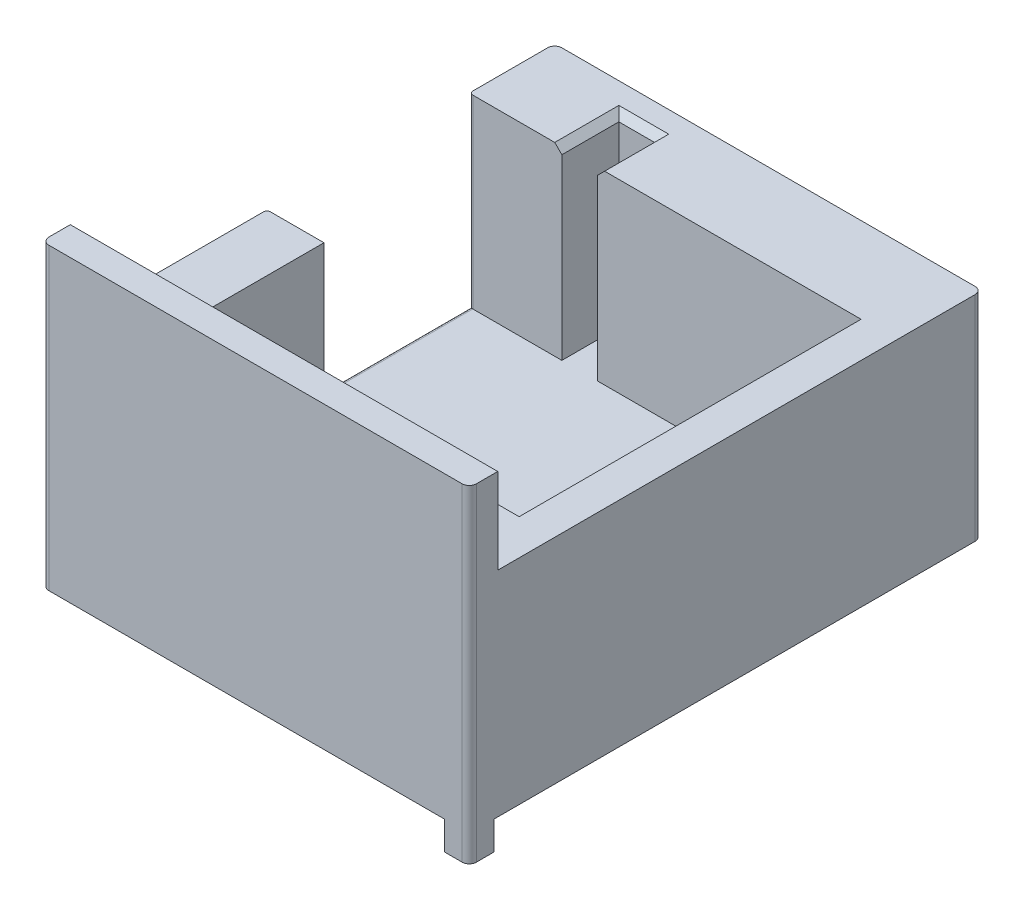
SolidWorks part; units mm, degrees
ref_plane "前视基准面" through (0, 0, 0) normal (0, 0, 1) x (1, 0, 0)
ref_plane "上视基准面" through (0, 0, 0) normal (0, 1, 0) x (1, 0, 0)
ref_plane "右视基准面" through (0, 0, 0) normal (1, 0, 0) x (0, 0, -1)
sketch "草图1" plane through (0, 0, 0) normal (0, 1, 0) x (1, 0, 0)
  line L1 (-15, -18) -> (15, -18)
  line L2 (-15, -18) -> (-15, 18)
  line L3 (-15, 18) -> (15, 18)
  line L4 (15, -18) -> (15, 18)
  line L5 (-15, -18) -> (15, 18) construction
  line L6 (-15, 18) -> (15, -18) construction
  point P0 (0, 0)
  dimension "D1" = 30
  dimension "D2" = 36
extrude "凸台-拉伸1" add sketch "草图1" along normal blind 15
sketch "草图4" plane through (0, 15, 0) normal (0, 1, 0) x (1, 0, 0)
  line L0 (-18.185, 0) -> (17.1592, 0) construction
  line L1 (12.5, 12) -> (12.5, -12)
  line L2 (12.5, -12) -> (-6, -12)
  line L3 (-6, -12) -> (-6, -16)
  line L4 (-6, -16) -> (-8.5, -16)
  line L5 (-8.5, -16) -> (-8.5, -12)
  line L6 (-8.5, -12) -> (-11, -12)
  line L7 (-15, 18) -> (-15, -18) construction
  line L8 (-11, -12) -> (-11, 12)
  line L9 (15, -18) -> (15, 18) construction
  line L10 (-8.5, 12) -> (-11, 12)
  line L11 (-8.5, 16) -> (-8.5, 12)
  line L12 (-6, 16) -> (-8.5, 16)
  line L13 (-6, 12) -> (-6, 16)
  line L14 (12.5, 12) -> (-6, 12)
  point P16 (-11, 0)
  point P21 (12.5, 0)
  dimension "D1" = 2.5
  dimension "D2" = 9
  dimension "D3" = 2.5
  dimension "D4" = 24
  dimension "D5" = 16
  dimension "D6" = 24
  dimension "D7" = 4
extrude "切除-拉伸3" cut sketch "草图4" against normal blind 13
sketch "草图6" plane through (-15, 0, 0) normal (-1, 0, 0) x (0, 0, 1)
  line L0 (0, 14.3) -> (0, 2) construction
  line L1 (-18, 0) -> (18, 0) construction
  line L2 (0, 8.15) -> (19.5542, 8.15) construction
  line L3 (12, 2) -> (12, 15) construction
  line L4 (12, 2) -> (12, 15) construction
  line L5 (12, 8.15) -> (12, 15)
  line L6 (12, 15) -> (-2.1962, 15)
  line L7 (-18, 15) -> (18, 15) construction
  line L8 (-2.1962, 15) -> (-2.1962, 8.15)
  line L9 (2.1962, 15) -> (2.1962, 8.15)
  line L10 (-12, 15) -> (2.1962, 15)
  line L11 (-12, 8.15) -> (-12, 15)
  circle A0 centre (6, 8.15) radius 6
  circle A1 centre (0.8038, 8.15) radius 3
  circle A2 centre (-0.8038, 8.15) radius 3
  circle A3 centre (-6, 8.15) radius 6
  point P13 (0.8038, 5.15)
  point P23 (-0.8038, 5.15)
  dimension "D3" = 12
  dimension "D4" = 6
  dimension "D1" = 2
  dimension "D2" = 12.3
extrude "切除-拉伸5" cut sketch "草图6" against normal up to next contours A3 A2 L8 | L11 A3 L8 M3 | A3 A1 L8 A2 | A3 A2 L8 A1 | A3 A1 | A1 A3 A0 A2 | A2 A0 | A3 L8 A2 | L8 A3 A2 A1 A0 L9 L6 | A0 A2 L9 A1 | A1 L9 A0 | A1 A2 A0 | A2 A3 A1
sketch "草图7" plane through (0, 0, 0) normal (0, -1, 0) x (1, 0, 0)
  line L1 (15, 18) -> (13, 18)
  line L2 (15, 18) -> (15, 16)
  line L3 (15, 16) -> (13, 16)
  line L4 (13, 18) -> (13, 16)
  dimension "D1" = 2
  dimension "D2" = 2
extrude "凸台-拉伸2" add sketch "草图7" along normal blind 2
sketch "草图8" plane through (15, 0, 0) normal (1, 0, 0) x (0, 0, -1)
  line L1 (-18, 15) -> (-16, 15)
  line L2 (-18, 15) -> (-18, 21)
  line L3 (-18, 21) -> (-16, 21)
  line L4 (-16, 15) -> (-16, 21)
  dimension "D1" = 2
  dimension "D2" = 6
extrude "凸台-拉伸3" add sketch "草图8" against normal up to surface (30 mm away)
chamfer "倒角1" distance 0.5 angle 45 5 edges at (-6, 15, -14) (-8.5, 15, -14) (-7.25, 15, -16)
fillet "圆角1" radius 0.5 4 edges at (-15, 7.5, -18) (15, 7.5, -18) (-15, 10.5, 18) (15, 9.5, 18)
chamfer "倒角2" distance 0.25 angle 45 3 edges at (13, -1, 16)
sketch "草图9" plane through (0, 2, 0) normal (0, 1, 0) x (1, 0, 0)
  line L0 (-5.5, -12) -> (12.5, -12) construction
  line L1 (12.5, 12) -> (9.5, 12)
  line L2 (12.5, 12) -> (12.5, -12)
  line L3 (12.5, -12) -> (9.5, -12)
  line L4 (9.5, 12) -> (9.5, -12)
  dimension "D1" = 3
extrude "切除-拉伸6" cut sketch "草图9" against normal blind 10
sketch "草图10" plane through (-15, 0, 0) normal (-1, 0, 0) x (0, 0, 1)
  line L0 (2.1962, 15) -> (2.1962, 8.15) construction
  line L1 (-12, 15) -> (2.1962, 15)
  line L2 (-12, 15) -> (-12, 2)
  line L3 (-12, 2) -> (2.1962, 2)
  line L4 (2.1962, 15) -> (2.1962, 2)
  line L7 (-12, 2) -> (12, 2) construction
extrude "切除-拉伸7" cut sketch "草图10" against normal up to next
fillet "圆角2" radius 0.25 3 edges at (-15, 8.5, 2.1962) (-15, 8.5, -12) (-15, 2, -4.9019)
